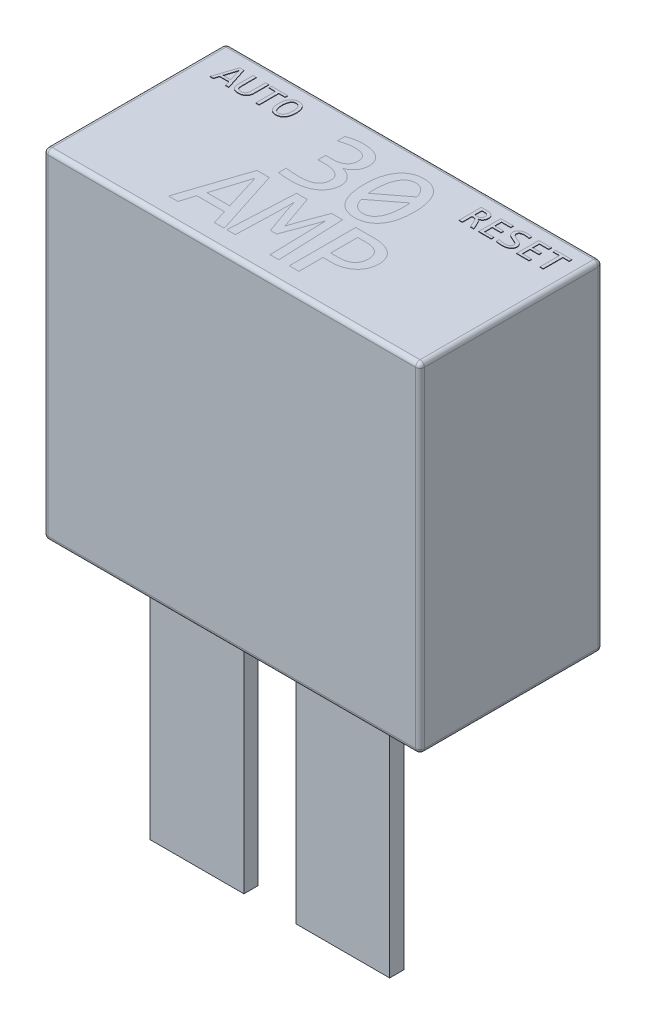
SolidWorks part; units mm, degrees
ref_plane "Front Plane" through (0, 0, 0) normal (0, 0, 1) x (1, 0, 0)
ref_plane "Top Plane" through (0, 0, 0) normal (0, 1, 0) x (1, 0, 0)
ref_plane "Right Plane" through (0, 0, 0) normal (1, 0, 0) x (0, 0, -1)
sketch "Sketch1" plane through (0, 0, 0) normal (0, 1, 0) x (1, 0, 0)
  line L1 (-6.8707, -3.048) -> (-1.4859, -3.048)
  line L2 (-6.8707, -3.048) -> (-6.8707, -2.2352)
  line L3 (-6.8707, -2.2352) -> (-1.4859, -2.2352)
  line L4 (-1.4859, -3.048) -> (-1.4859, -2.2352)
  line L5 (-6.8707, -3.048) -> (-1.4859, -2.2352) construction
  line L6 (-6.8707, -2.2352) -> (-1.4859, -3.048) construction
  line L7 (1.4859, -3.048) -> (6.8707, -3.048)
  line L8 (1.4859, -3.048) -> (1.4859, -2.2352)
  line L9 (1.4859, -2.2352) -> (6.8707, -2.2352)
  line L10 (6.8707, -3.048) -> (6.8707, -2.2352)
  line L11 (1.4859, -3.048) -> (6.8707, -2.2352) construction
  line L12 (1.4859, -2.2352) -> (6.8707, -3.048) construction
  point P0 (-4.1783, -2.6416)
  point P5 (4.1783, -2.6416)
  dimension "D1" = 0.8128
  dimension "D2" = 0.8128
  dimension "D3" = 5.3848
  dimension "D4" = 5.3848
  dimension "D5" = 2.9718
  dimension "D6" = 1.4859
  dimension "D7" = 2.6416
  dimension "D8" = 0
extrude "Boss-Extrude1" add sketch "Sketch1" against normal blind 14.478
chamfer "Chamfer1" distance 0.4064 angle 45 4 edges at (-4.1783, -14.478, 2.2352) (-4.1783, -14.478, 3.048) (-6.8707, -14.478, 2.6416) (-1.4859, -14.478, 2.6416)
chamfer "Chamfer2" distance 0.4064 angle 45 4 edges at (6.8707, -14.478, 2.6416) (4.1783, -14.478, 2.2352) (4.1783, -14.478, 3.048) (1.4859, -14.478, 2.6416)
sketch "Sketch3" plane through (0, 0, 0) normal (0, 1, 0) x (1, 0, 0)
  line L1 (10.795, 5.2324) -> (-10.795, 5.2324)
  line L2 (10.795, 5.2324) -> (10.795, -5.2324)
  line L3 (10.795, -5.2324) -> (-10.795, -5.2324)
  line L4 (-10.795, 5.2324) -> (-10.795, -5.2324)
  line L5 (10.795, 5.2324) -> (-10.795, -5.2324) construction
  line L6 (10.795, -5.2324) -> (-10.795, 5.2324) construction
  point P0 (0, 0)
  dimension "D1" = 10.4648
  dimension "D2" = 21.59
extrude "Boss-Extrude2" add sketch "Sketch3" along normal blind 19.431
fillet "Fillet1" radius 0.254 12 edges at (10.795, 19.431, 0) (0, 19.431, -5.2324) (-10.795, 19.431, 0) (-10.795, 9.7155, 5.2324) (-10.795, 9.7155, -5.2324) (10.795, 9.7155, -5.2324) (-10.795, 0, 0) (0, 0, -5.2324) (10.795, 0, 0) (0, 0, 5.2324) (10.795, 9.7155, 5.2324) (0, 19.431, 5.2324)
sketch "Sketch4" plane through (0, 19.431, 0) normal (0, 1, 0) x (1, 0, 0)
  text T0 "30" font "Consolas" height 3.81
  text T1 "AMP" font "Consolas" height 3.81
  dimension "D1" = 0.254
  dimension "D2" = 4.064
  dimension "D3" = 3.302
  dimension "D4" = 4.826
extrude "Cut-Extrude1" cut sketch "Sketch4" against normal blind 0.0254
sketch "Sketch5" plane through (0, 19.431, 0) normal (0, 1, 0) x (1, 0, 0)
  text T0 "30" font "Consolas" height 3.81
  text T1 "AMP" font "Consolas" height 3.81
  dimension "D1" = 0.254
  dimension "D2" = 3.302
  dimension "D3" = 4.064
  dimension "D4" = 4.826
extrude "Boss-Extrude3" add sketch "Sketch5" against normal blind 0.0254 separate body
sketch "Sketch7" plane through (0, 19.431, 0) normal (0, 1, 0) x (1, 0, 0)
  text T0 "AUTO         RESET" font "Consolas" height 1.27
  dimension "D1" = 9.525
  dimension "D2" = 3.048
extrude "Cut-Extrude2" cut sketch "Sketch7" against normal blind 0.0254
sketch "Sketch8" plane through (0, 19.431, 0) normal (0, 1, 0) x (1, 0, 0)
  text T0 "AUTO         RESET" font "Consolas" height 1.27
  dimension "D1" = 3.048
  dimension "D2" = 9.525
extrude "Boss-Extrude4" add sketch "Sketch8" along normal blind 0.0254 separate body
